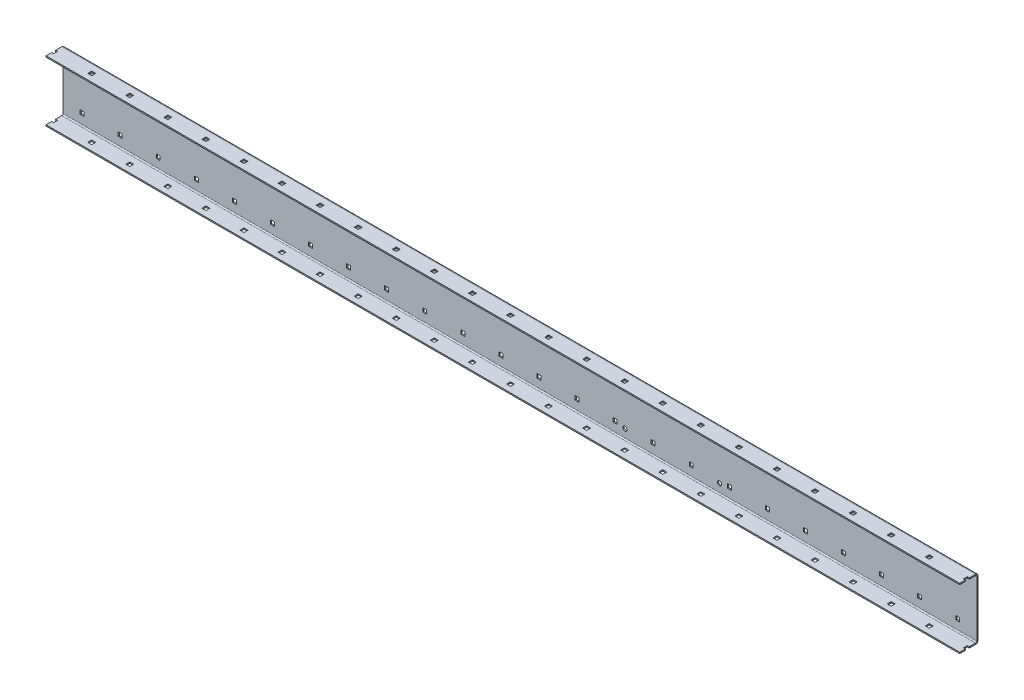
SolidWorks part; units mm, degrees
ref_plane "Front" through (0, 0, 0) normal (0, 0, 1) x (1, 0, 0)
ref_plane "Top" through (0, 0, 0) normal (0, 1, 0) x (1, 0, 0)
ref_plane "Right" through (0, 0, 0) normal (1, 0, 0) x (0, 0, -1)
sketch "Esquisse1" plane through (0, 0, 0) normal (0, 0, 1) x (1, 0, 0)
  line L1 (0, 100) -> (3000, 100)
  line L2 (0, 100) -> (0, -100)
  line L3 (0, -100) -> (3000, -100)
  line L4 (3000, 100) -> (3000, -100)
  dimension "longeur chassi" = 3000
  dimension "hauteur chassi" = 200
  dimension "D3" = 100
extrude "Base-Extrusion" add sketch "Esquisse1" along normal blind 60
sketch "Esquisse2" plane through (0, 0, 60) normal (0, 0, 1) x (1, 0, 0)
  line L1 (0, 96) -> (3000, 96)
  line L2 (0, 96) -> (0, -96)
  line L3 (0, -96) -> (3000, -96)
  line L4 (3000, 96) -> (3000, -96)
  line L5 (0, -100) -> (3000, -100) construction
  line L6 (0, 100) -> (0, -100) construction
  dimension "D1" = 192
  dimension "D2" = 4
  dimension "D4" = 3000
extrude "Enlèv. mat.-Extru.1" cut sketch "Esquisse2" against normal blind 56
sketch "Esquisse4" plane through (0, 0, 4) normal (0, 0, 1) x (1, 0, 0)
  line L0 (62.5, 74.6944) -> (62.5, 48.8766) construction
  line L1 (56, 66.5) -> (69, 66.5)
  line L2 (56, 66.5) -> (56, 53.5)
  line L3 (56, 53.5) -> (69, 53.5)
  line L4 (69, 66.5) -> (69, 53.5)
  line L5 (50.6788, 60) -> (73.5404, 60) construction
  line L6 (0, 96) -> (0, -96) construction
  line L8 (3000, 100) -> (0, 100) construction
  line L147 (-15.4194, 0) -> (3060.0811, 0) construction
  line L148 (62.5, -46.6389) -> (62.5, -67.8292) construction
  line L149 (56, -53.5) -> (69, -53.5)
  line L150 (56, -53.5) -> (56, -66.5)
  line L151 (56, -66.5) -> (69, -66.5)
  line L152 (69, -53.5) -> (69, -66.5)
  line L161 (73.5404, -60) -> (46.3913, -60) construction
  line L162 (0, -100) -> (3000, -100) construction
  dimension "D1" = 13
  dimension "D2" = 13
  dimension "D3" = 6.5
  dimension "D4" = 6.5
  dimension "D5" = 62.5
  dimension "D6" = 40
  dimension "D124" = 13
  dimension "D127" = 13
  dimension "D130" = 6.5
  dimension "D131" = 6.5
  dimension "D132" = 40
extrude "Enlèv. mat.-Extru.3" cut sketch "Esquisse4" against normal through all
sketch "Esquisse6" plane through (0, -100, 0) normal (0, -1, 0) x (1, 0, 0)
  line L0 (-49.3497, 35) -> (3046.7993, 35) construction
  line L1 (0, 60) -> (0, 4) construction
  line L9 (-6.5, 41.5) -> (6.5, 41.5)
  line L10 (-6.5, 41.5) -> (-6.5, 28.5)
  line L11 (-6.5, 28.5) -> (6.5, 28.5)
  line L12 (6.5, 41.5) -> (6.5, 28.5)
  line L13 (0, 60) -> (3000, 60) construction
  dimension "D7" = 13
  dimension "D9" = 6.5
  dimension "D10" = 13
  dimension "D11" = 25
  dimension "D128" = 6.5
extrude "Enlèv. mat.-Extru.4" cut sketch "Esquisse6" against normal through all
sheet metal parameters "Tôlerie 1" parameters "D1"=4, "Epaisseur"=4
bend "Pli dans angle2" bend angle 90 parameters "D1"=0, "D5"=1
flatten bends "Dépliage 1" parameters "D1"=0
sketch "Esquisse-Angle1" plane through (0, 0, 4) normal (0, 0, 1) x (1, 0, 0)
  line L0 (3000, 95.1479) -> (0, 95.1479) construction
  line L1 (0, -95.1479) -> (3000, -95.1479) construction
bend "Pli dans angle1" bend angle 90 parameters "D1"=0, "D5"=2
process bends "Pliage 1" parameters "D1"=0
sketch "Esquisse-Plate1" plane through (0, 0, 4) normal (0, 0, 1) x (1, 0, 0)
pattern_linear "Répétition linéaire1" count 24 spacing 125 along (1, 0, 0) of "Enlèv. mat.-Extru.3"
pattern_linear "Répétition linéaire2" count 25 spacing 125 along (1, 0, 0) of "Enlèv. mat.-Extru.4"
sketch "Esquisse9" plane through (0, 0, 0) normal (0, 0, -1) x (-1, 0, 0)
  line L0 (0, -100) -> (-3000, -100) construction
  line L1 (-3000, -92) -> (-3000, 92) construction
  line L2 (0, -100) -> (-3000, -100) construction
  circle A0 centre (-1845, 54) radius 7
  circle A1 centre (-1845, -66) radius 7
  circle A2 centre (-2155, 54) radius 7
  circle A3 centre (-2155, -66) radius 7
  dimension "D4" = 34
  dimension "D1" = 120
  dimension "D2" = 120
  dimension "D3" = 310
  dimension "D5" = 310
  dimension "D6" = 845
  dimension "D7" = 34
extrude "Enlèv. mat.-Extru.5" cut sketch "Esquisse9" against normal blind 10
